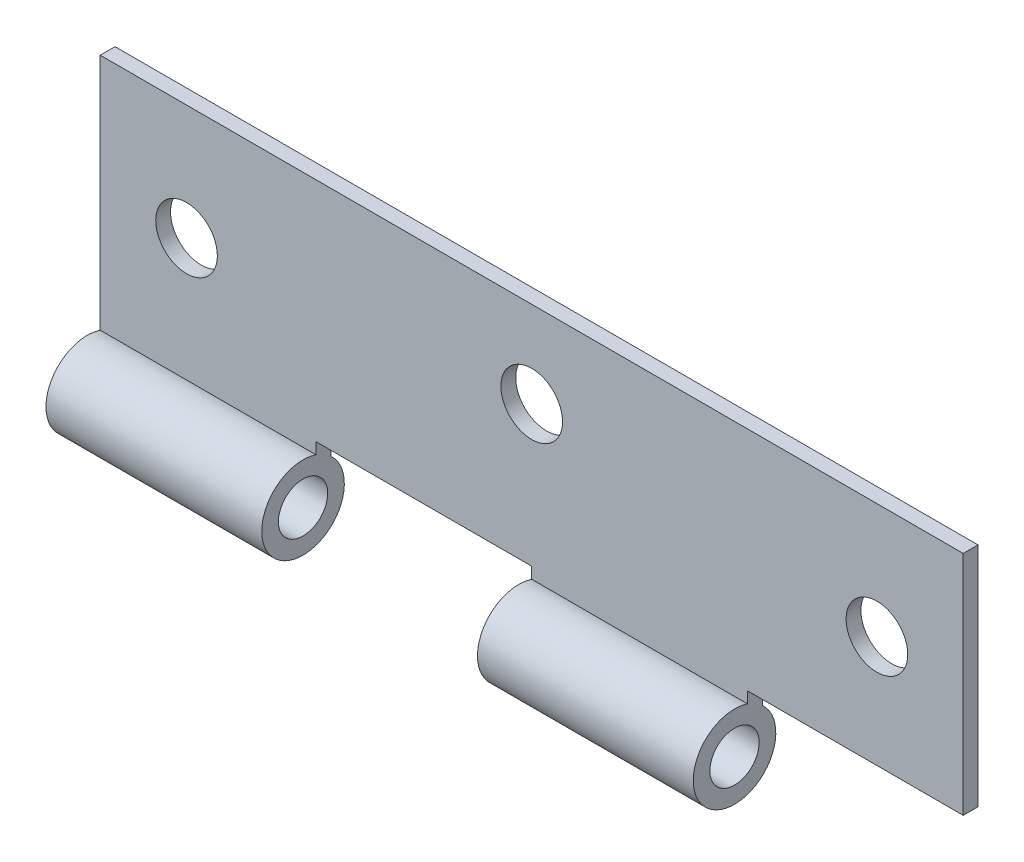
SolidWorks part; units mm, degrees
ref_plane "Front Plane" through (0, 0, 0) normal (0, 0, 1) x (1, 0, 0)
ref_plane "Top Plane" through (0, 0, 0) normal (0, 1, 0) x (1, 0, 0)
ref_plane "Right Plane" through (0, 0, 0) normal (1, 0, 0) x (0, 0, -1)
body saved out of another part "Stock-Door hinge-1"
